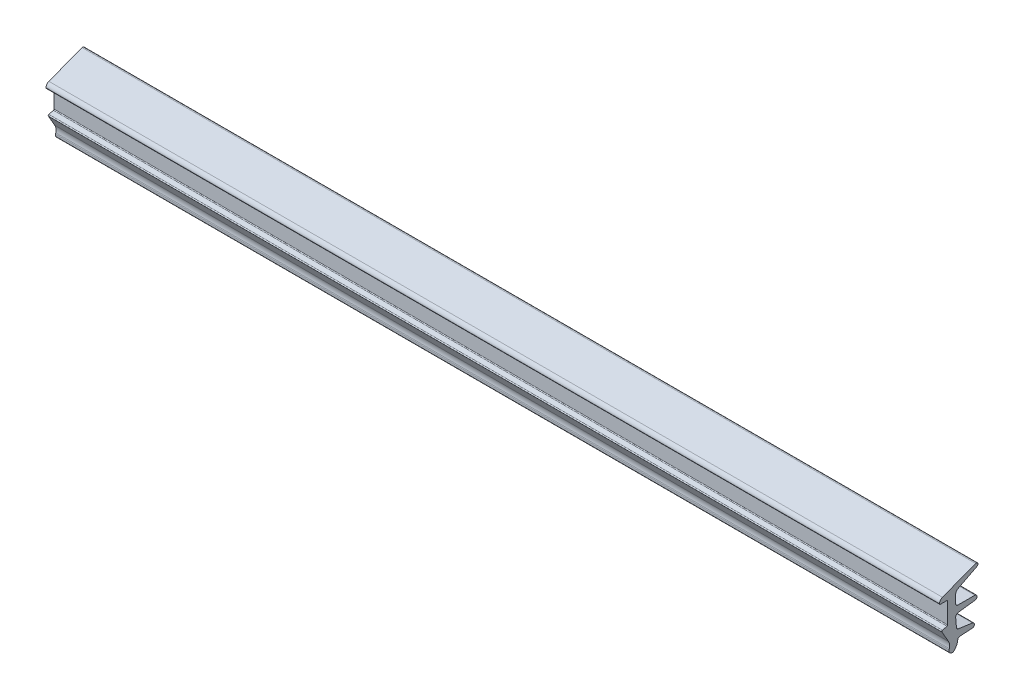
SolidWorks part; units mm, degrees
ref_plane "Front Plane" through (0, 0, 0) normal (0, 0, 1) x (1, 0, 0)
ref_plane "Top Plane" through (0, 0, 0) normal (0, 1, 0) x (1, 0, 0)
ref_plane "Right Plane" through (0, 0, 0) normal (1, 0, 0) x (0, 0, -1)
sketch3d "3DSketch1"
  line L0 (0, 0, 0) -> (200, 0, 0)
other "Paneelitiivisteet 1.6020 PANEELITIIVISTE 4(1)"
ref_plane "Plane1" through (0, 0, 0) normal (1, 0, 0) x (0, 0, -1)
sketch "Sketch1" plane through (0, 0, 0) normal (1, 0, 0) x (0, 0, -1)
  line L0 (1.3912, 4.4097) -> (5.6268, 6.5678)
  line L1 (5.3021, 7.2977) -> (-2.1125, 4.4581)
  line L2 (-2.5548, 3.3242) -> (-1.1548, 3.3242)
  line L3 (-0.9548, 3.1242) -> (-0.9548, -1.4758)
  line L4 (-1.1031, -1.669) -> (-2.1066, -1.9379)
  line L5 (-2.228, -2.2311) -> (-0.7712, -4.7545)
  line L6 (-0.5714, -6.2721) -> (-0.631, -6.4946)
  line L7 (1.7938, -5.045) -> (4.5757, -4.8749)
  line L8 (4.6147, -3.8807) -> (1.451, -3.436)
  line L9 (1.0225, -2.9845) -> (0.8478, -0.9878)
  line L10 (1.4599, -0.2321) -> (5.2061, 0.2279)
  line L11 (5.1452, 1.2242) -> (1.3452, 1.2242)
  line L12 (0.8452, 1.7242) -> (0.8452, 3.5187)
  arc A0 (1.3912, 4.4097) -> (0.8452, 3.5187) centre (1.8452, 3.5187) ccw
  arc A1 (5.6268, 6.5678) -> (5.3021, 7.2977) centre (5.4452, 6.9242) ccw
  arc A2 (-2.1125, 4.4581) -> (-2.7548, 3.5242) centre (-1.7548, 3.5242) ccw
  arc A3 (-2.7548, 3.5242) -> (-2.5548, 3.3242) centre (-2.5548, 3.5242) ccw
  arc A4 (-0.9548, 3.1242) -> (-1.1548, 3.3242) centre (-1.1548, 3.1242) ccw
  arc A5 (-1.1031, -1.669) -> (-0.9548, -1.4758) centre (-1.1548, -1.4758) ccw
  arc A6 (-2.1066, -1.9379) -> (-2.228, -2.2311) centre (-2.0548, -2.1311) ccw
  arc A7 (-0.5714, -6.2721) -> (-0.7712, -4.7545) centre (-2.5032, -5.7545) ccw
  arc A8 (-0.631, -6.4946) -> (0.5703, -7.1387) centre (0.0452, -6.6758) ccw
  arc A9 (0.5703, -7.1387) -> (1.3276, -5.4874) centre (-1.5728, -5.1566) ccw
  arc A10 (1.7938, -5.045) -> (1.3276, -5.4874) centre (1.8243, -5.5441) ccw
  arc A11 (4.5757, -4.8749) -> (4.6147, -3.8807) centre (4.5452, -4.3758) ccw
  arc A12 (1.0225, -2.9845) -> (1.451, -3.436) centre (1.5206, -2.9409) ccw
  arc A13 (1.4599, -0.2321) -> (0.8478, -0.9878) centre (1.5452, -0.9268) ccw
  arc A14 (5.2061, 0.2279) -> (5.1452, 1.2242) centre (5.1452, 0.7242) ccw
  arc A15 (0.8452, 1.7242) -> (1.3452, 1.2242) centre (1.3452, 1.7242) ccw
  point P45 (0, 0)
